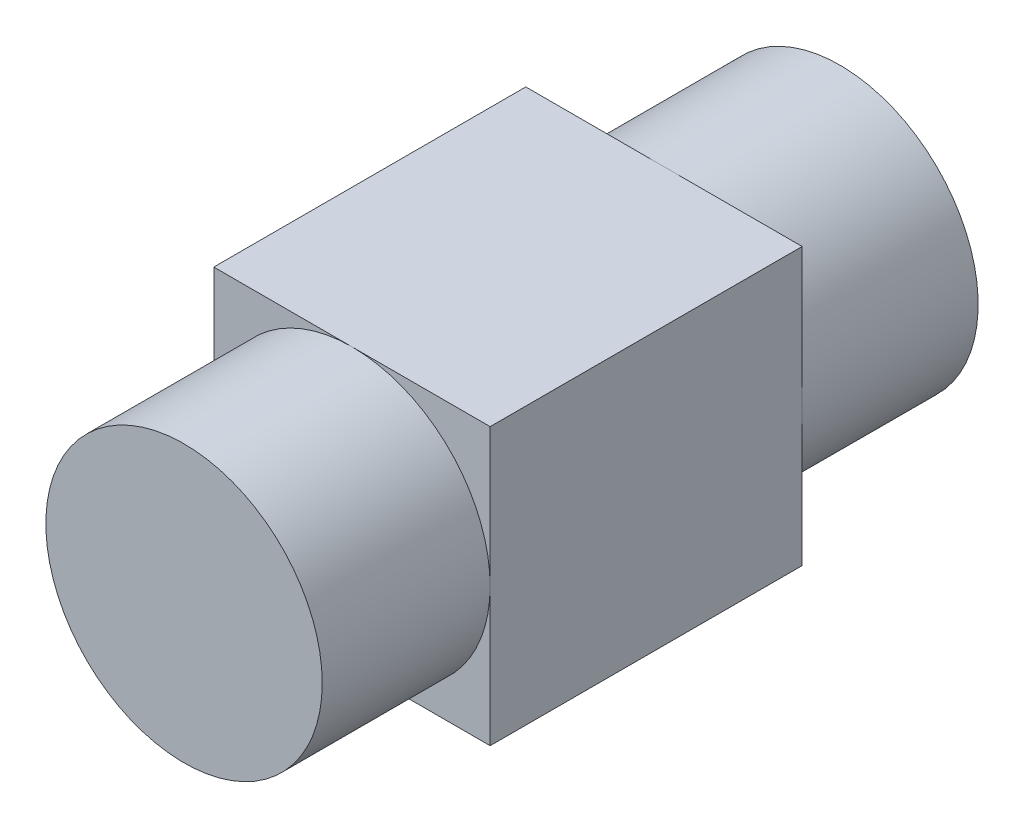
SolidWorks part; units mm, degrees
ref_plane "Front Plane" through (0, 0, 0) normal (0, 0, 1) x (1, 0, 0)
ref_plane "Top Plane" through (0, 0, 0) normal (0, 1, 0) x (1, 0, 0)
ref_plane "Right Plane" through (0, 0, 0) normal (1, 0, 0) x (0, 0, -1)
sketch "Sketch1" plane through (0, 0, 0) normal (0, 0, 1) x (1, 0, 0)
  line L1 (-4.7625, 4.7625) -> (4.7625, 4.7625)
  line L2 (-4.7625, 4.7625) -> (-4.7625, -4.7625)
  line L3 (-4.7625, -4.7625) -> (4.7625, -4.7625)
  line L4 (4.7625, 4.7625) -> (4.7625, -4.7625)
  line L5 (-4.7625, 4.7625) -> (4.7625, -4.7625) construction
  line L6 (-4.7625, -4.7625) -> (4.7625, 4.7625) construction
  point P0 (0, 0)
  dimension "D1" = 9.525
  dimension "D2" = 9.525
extrude "Boss-Extrude1" add sketch "Sketch1" along normal blind 59.436
ref_plane "Plane1" through (0, 0, 57.531) normal (0, 0, 1) x (1, 0, 0)
ref_plane "Plane2" through (0, 0, 30.1955) normal (0, 0, 1) x (1, 0, 0)
sketch "Sketch2" plane through (0, 0, 57.531) normal (0, 0, 1) x (1, 0, 0)
  circle A0 centre (0, 0) radius 4.7625
  dimension "D1" = 9.525
extrude "Cut-Extrude1" cut sketch "Sketch2" along normal through all flip side to cut
sketch "Sketch3" plane through (0, 0, 30.1955) normal (0, 0, 1) x (1, 0, 0)
  circle A0 centre (0, 0) radius 4.7625
  dimension "D1" = 9.525
extrude "Cut-Extrude2" cut sketch "Sketch3" against normal through all flip side to cut
sketch "Sketch6" plane through (4.7625, 0, 0) normal (0, 1, 0) x (0, 0, -1)
  line L0 (-40.9484, 14.6367) -> (-40.9484, 9.525)
  line L1 (-40.9484, 9.525) -> (-46.736, 9.525)
  line L2 (-46.736, 9.525) -> (-46.736, 4.7625)
  line L3 (-46.736, 4.7625) -> (-59.436, 4.7625)
  line L4 (-59.436, 4.7625) -> (-59.436, 14.6367)
  line L5 (-59.436, 14.6367) -> (-40.9484, 14.6367)
  line L7 (-59.436, 9.525) -> (-59.436, 0) construction
  line L8 (-63.8385, 4.7625) -> (-26.8924, 4.7625) construction
  line L9 (-57.531, 9.525) -> (-30.1955, 9.525) construction
  dimension "D1" = 12.7
revolve "Cut-Revolve2" cut sketch "Sketch6" angle 360 about L8
sketch "Sketch7" plane through (0, 0, 0) normal (0, 0, -1) x (-1, 0, 0)
  circle A0 centre (0, 0) radius 4.7625
extrude "Cut-Extrude3" cut sketch "Sketch7" against normal blind 24.13
